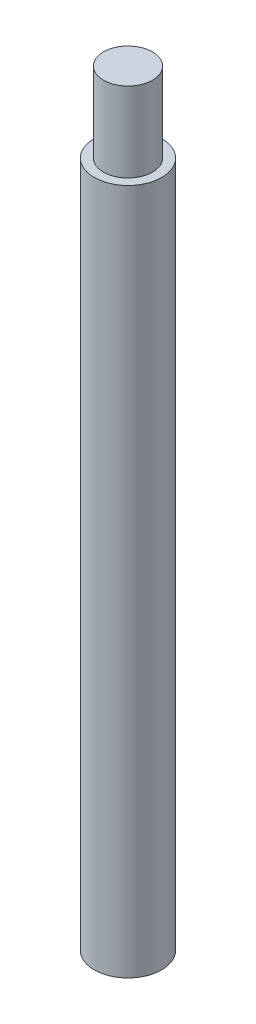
SolidWorks part; units mm, degrees
ref_plane "front" through (0, 0, 0) normal (0, 0, 1) x (1, 0, 0)
ref_plane "top" through (0, 0, 0) normal (0, 1, 0) x (1, 0, 0)
ref_plane "side" through (0, 0, 0) normal (1, 0, 0) x (0, 0, -1)
sketch "Sketch1" plane through (0, 0, 0) normal (0, 1, 0) x (1, 0, 0)
  circle A0 centre (0, 0) radius 17.4625
  dimension "D1" = 34.925
extrude "Base-Extrude" add sketch "Sketch1" along normal blind 355.6
sketch "Sketch2" plane through (0, 355.6, 0) normal (0, 1, 0) x (-1, 0, 0)
  circle A0 centre (0, 0) radius 12.7
  dimension "D1" = 25.4
extrude "Boss-Extrude1" add sketch "Sketch2" along normal blind 41.275
